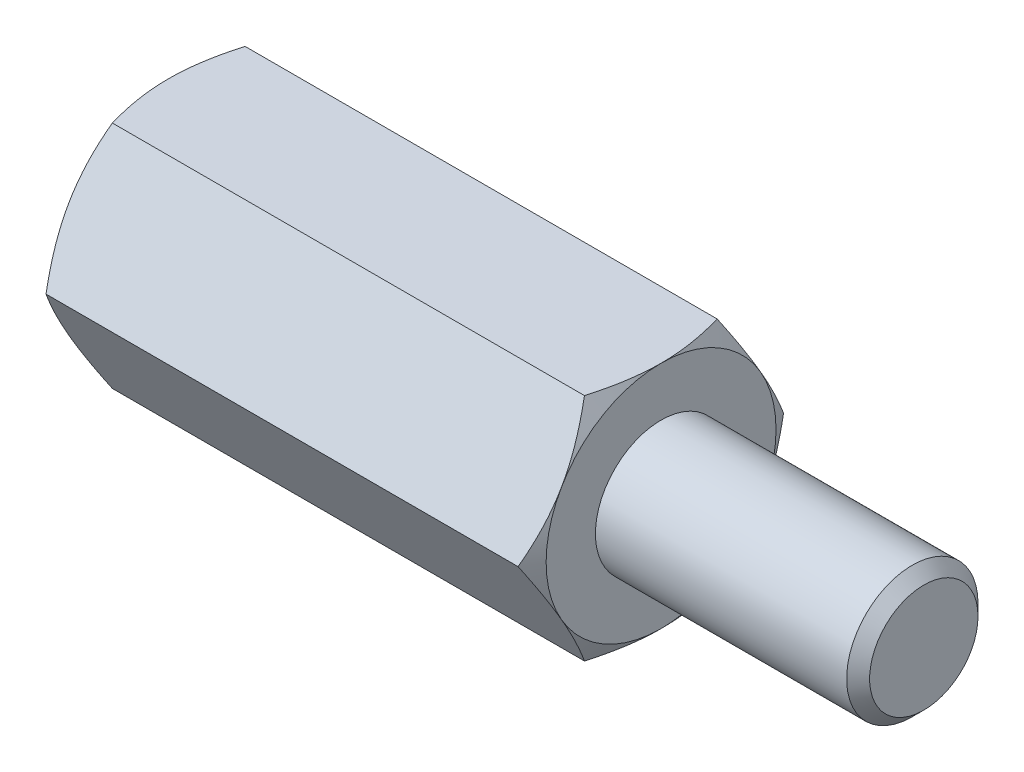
SolidWorks part; units mm, degrees
ref_plane "Front Plane" through (0, 0, 0) normal (0, 0, 1) x (1, 0, 0)
ref_plane "Top Plane" through (0, 0, 0) normal (0, 1, 0) x (1, 0, 0)
ref_plane "Right Plane" through (0, 0, 0) normal (1, 0, 0) x (0, 0, -1)
sketch "Sketch1" plane through (0, 0, 0) normal (1, 0, 0) x (0, 0, -1)
  line L1 (2.0207, 3.5) -> (-2.0207, 3.5)
  line L2 (-2.0207, 3.5) -> (-4.0415, 0)
  line L3 (-4.0415, 0) -> (-2.0207, -3.5)
  line L4 (-2.0207, -3.5) -> (2.0207, -3.5)
  line L5 (2.0207, -3.5) -> (4.0415, 0)
  line L6 (4.0415, 0) -> (2.0207, 3.5)
  circle A0 centre (0, 0) radius 3.5 construction
  dimension "D1" = 7
extrude "Extrude2" add sketch "Sketch1" along normal mid plane 15
sketch "Sketch2" plane through (0, 0, 0) normal (0, 0, 1) x (1, 0, 0)
  line L0 (-7.5, 3.5) -> (-6, 6.0981)
  line L1 (-7.5, 6.5) -> (-7.5, 3.5)
  line L3 (0, 0) -> (50000, 0) construction
  arc A0 (-6, 6.0981) -> (-7.5, 6.5) centre (-6.6962, 6.5) ccw
  dimension "D1" = 30
  dimension "D2" = 3
revolve "Cut-Revolve1" cut sketch "Sketch2" angle 360 about L3
mirror "Mirror1" about plane through (0, 0, 0) normal (1, 0, 0) of "Cut-Revolve1"
sketch "Sketch3" plane through (-7.5, 0, 0) normal (-1, 0, 0) x (0, 0, 1)
  circle A0 centre (0, 0) radius 1.65
  dimension "D1" = 3.3
extrude "Extrude3" cut sketch "Sketch3" against normal blind 8
sketch "Sketch4" plane through (0, 0, 0) normal (0, 0, 1) x (1, 0, 0)
  line L0 (0.5, 0) -> (0.5, 1.65)
  line L1 (7.1874, 0) -> (-7.1874, 0) construction
  line L2 (0.5, 1.65) -> (1.4526, 0)
  line L3 (1.4526, 0) -> (0.5, 0)
  line L4 (-7.5, 1.75) -> (-7.5, -1.75) construction
  point P4 (-7.5, 0)
  dimension "D1" = 30
  dimension "D2" = 1.65
  dimension "D3" = 8
revolve "Cut-Revolve2" cut sketch "Sketch4" angle 360 about L3
sketch "Sketch5" plane through (7.5, 0, 0) normal (1, 0, 0) x (0, 0, -1)
  circle A0 centre (0, 0) radius 2
  dimension "D1" = 4
extrude "Extrude4" add sketch "Sketch5" along normal blind 8
chamfer "Chamfer1" distance 0.35 angle 45 1 edges at (15.5, 0, -2)
equation "\"D2@Sketch4\" = \"D1@Sketch3\"/2"
